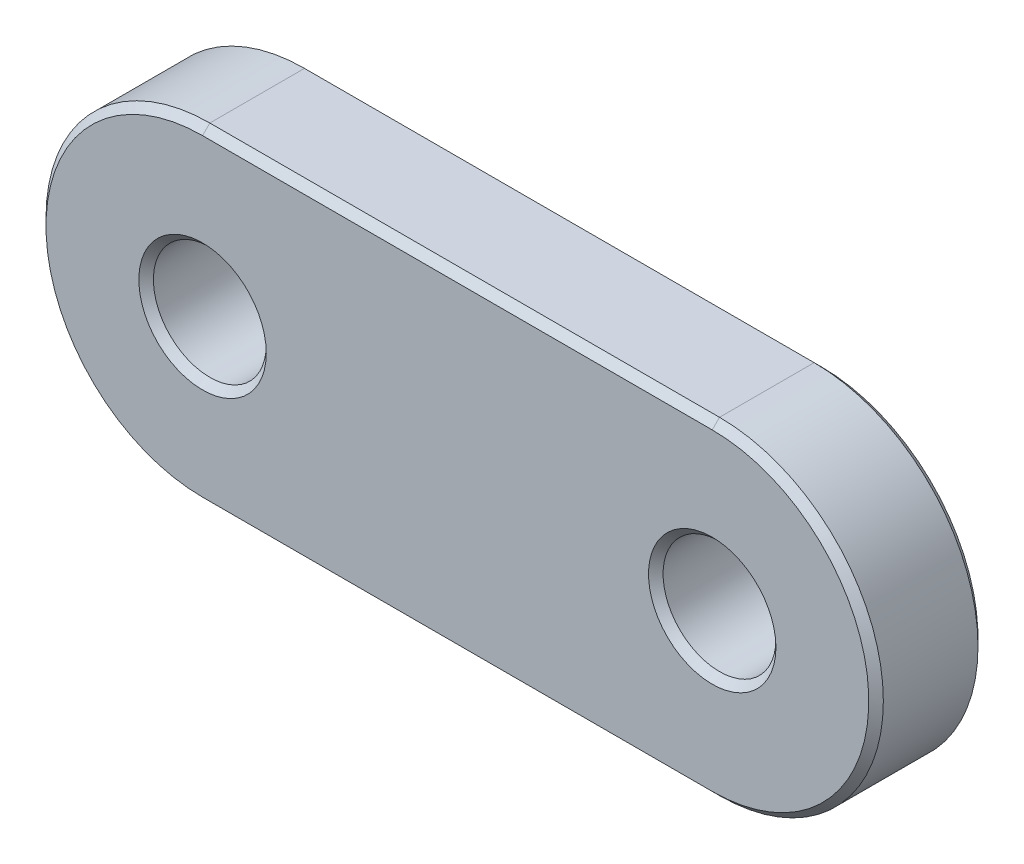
SolidWorks part; units mm, degrees
ref_plane "前视基准面" through (0, 0, 0) normal (0, 0, 1) x (1, 0, 0)
ref_plane "上视基准面" through (0, 0, 0) normal (0, 1, 0) x (1, 0, 0)
ref_plane "右视基准面" through (0, 0, 0) normal (1, 0, 0) x (0, 0, -1)
sketch "草图1" plane through (0, 0, 0) normal (0, 0, 1) x (1, 0, 0)
  line L1 (7, -4.5) -> (-7, -4.5)
  line L3 (7, 4.5) -> (-7, 4.5)
  line L5 (7, -4.5) -> (-7, 4.5) construction
  line L6 (7, 4.5) -> (-7, -4.5) construction
  arc A0 (-7, 4.5) -> (-7, -4.5) centre (-7, 0) ccw
  arc A1 (7, -4.5) -> (7, 4.5) centre (7, 0) ccw
  circle A2 centre (-7, 0) radius 1.55
  circle A3 centre (7, 0) radius 1.55
  point P0 (0, 0)
  dimension "D1" = 3.1
  dimension "D2" = 14
  dimension "D3" = 9
extrude "凸台-拉伸1" add sketch "草图1" along normal mid plane 3
chamfer "倒角1" distance 0.2 angle 45 8 edges at (0, -4.5, -1.5) (-11.5, 0, -1.5) (11.5, 0, -1.5) (0, 4.5, -1.5) (0, -4.5, 1.5) (-11.5, 0, 1.5) (11.5, 0, 1.5) (0, 4.5, 1.5)
chamfer "倒角2" distance 0.2 angle 45 4 edges at (-5.45, 0, -1.5) (8.55, 0, -1.5) (8.55, 0, 1.5) (-5.45, 0, 1.5)
equation "\"Dummy1\"= \"图号代码\""
equation "\"Dummy2\"= \"名称代码\""
